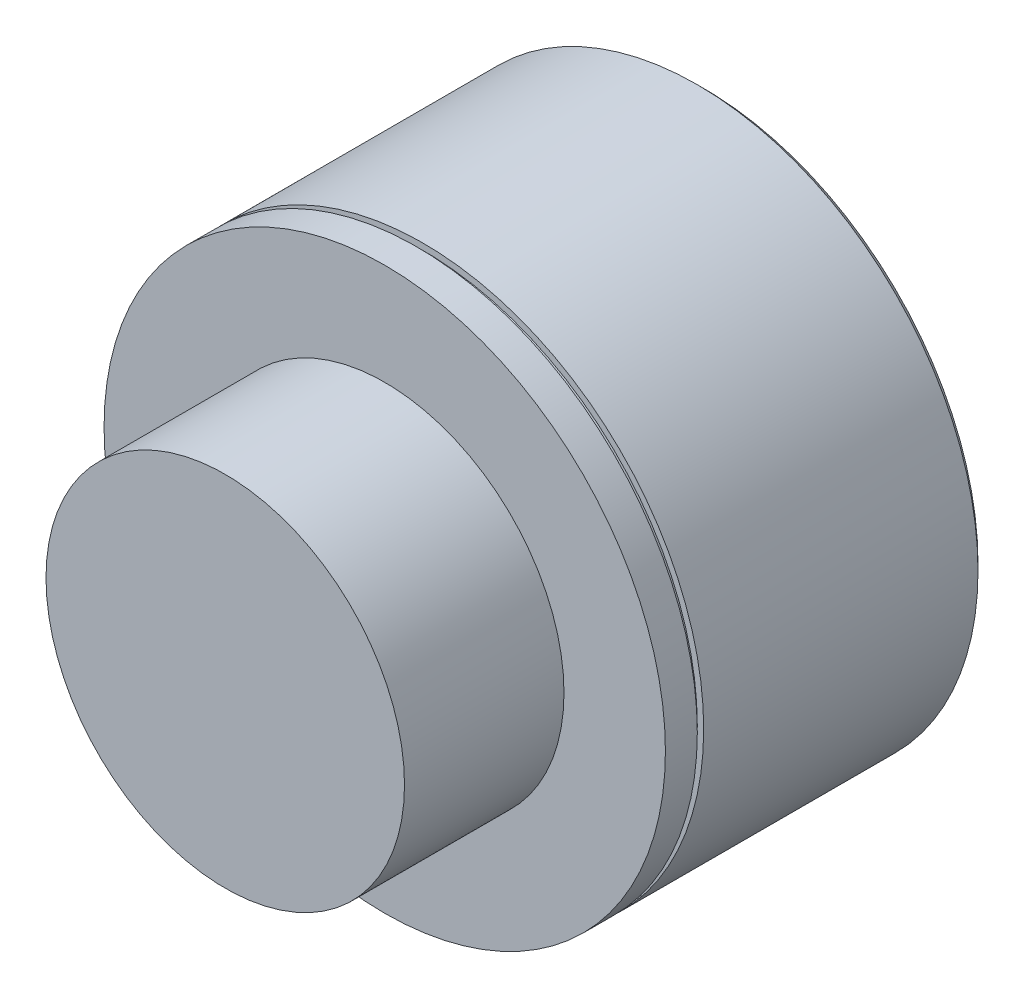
SolidWorks part; units mm, degrees
ref_plane "Front Plane" through (0, 0, 0) normal (0, 0, 1) x (1, 0, 0)
ref_plane "Top Plane" through (0, 0, 0) normal (0, 1, 0) x (1, 0, 0)
ref_plane "Right Plane" through (0, 0, 0) normal (1, 0, 0) x (0, 0, -1)
sketch "Sketch1" plane through (0, 0, 0) normal (0, 0, 1) x (1, 0, 0)
  circle A0 centre (0, 0) radius 3.5687
  dimension "D1" = 7.1374
extrude "Boss-Extrude1" add sketch "Sketch1" along normal blind 3.175
sketch "Sketch2" plane through (0, 0, 0) normal (0, 0, -1) x (-1, 0, 0)
  circle A0 centre (0, 0) radius 5.588
  dimension "D1" = 11.176
extrude "Boss-Extrude2" add sketch "Sketch2" along normal blind 6.35
chamfer "Chamfer1" distance 0.127 angle 45 1 edges at (-5.588, 0, -6.35)
sketch "Sketch3" plane through (0, 0, 0) normal (1, 0, 0) x (0, 0, -1)
  line L0 (6.223, 5.588) -> (0, 5.588) construction
  line L1 (0.635, 5.588) -> (0.762, 5.588)
  line L2 (0.635, 5.588) -> (0.635, 5.461)
  line L3 (0.635, 5.461) -> (0.762, 5.461)
  line L4 (0.762, 5.588) -> (0.762, 5.461)
  line L5 (0, 5.588) -> (0, -5.588) construction
  line L6 (0, 0) -> (10.8349, 0) construction
  dimension "D1" = 0.127
  dimension "D2" = 0.635
  dimension "D3" = 0.127
revolve "Cut-Revolve1" cut sketch "Sketch3" angle 360 about L6
